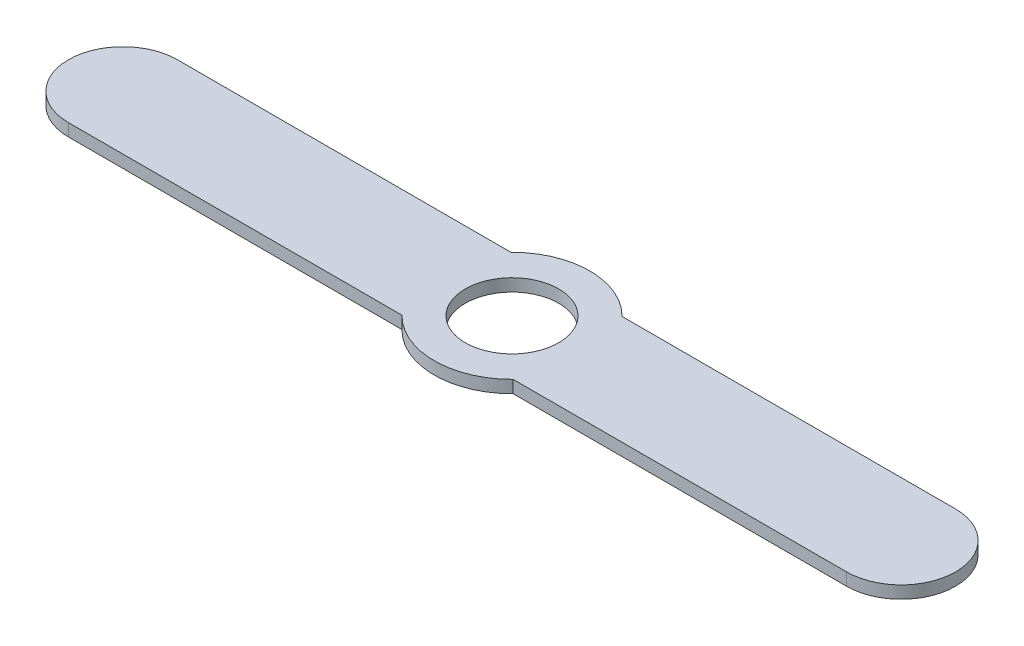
SolidWorks part; units mm, degrees
ref_plane "Front Plane" through (0, 0, 0) normal (0, 0, 1) x (1, 0, 0)
ref_plane "Top Plane" through (0, 0, 0) normal (0, 1, 0) x (1, 0, 0)
ref_plane "Right Plane" through (0, 0, 0) normal (1, 0, 0) x (0, 0, -1)
sketch "Sketch1" plane through (0, 0, 0) normal (0, 1, 0) x (1, 0, 0)
  line L7 (-31.75, 4.445) -> (31.75, 4.445)
  line L8 (-31.75, 4.445) -> (-31.75, -4.445)
  line L9 (-31.75, -4.445) -> (31.75, -4.445)
  line L10 (31.75, 4.445) -> (31.75, -4.445)
  line L11 (-31.75, 4.445) -> (31.75, -4.445) construction
  line L12 (-31.75, -4.445) -> (31.75, 4.445) construction
  circle A3 centre (-31.75, 0) radius 4.445
  circle A4 centre (31.75, 0) radius 4.445
  circle A5 centre (0, 0) radius 6.35
  point P0 (0, 0)
  dimension "D1" = 63.5
  dimension "D2" = 8.89
  dimension "D3" = 12.7
extrude "Boss-Extrude1" add sketch "Sketch1" along normal blind 1.016 contours L8 A3 | L8 A3 | A5 L7 A3 L9 | L9 A5 L7 | L9 A5 | A5 L9 A4 L7 | L10 A4 | L10 A4
sketch "Sketch2" plane through (0, 1.016, 0) normal (0, 1, 0) x (1, 0, 0)
  circle A0 centre (0, 0) radius 3.81
  dimension "D1" = 7.62
extrude "Cut-Extrude1" cut sketch "Sketch2" against normal through all
scale "Scale1" scale about centroid uniform scaling yes scale factor 0.5
